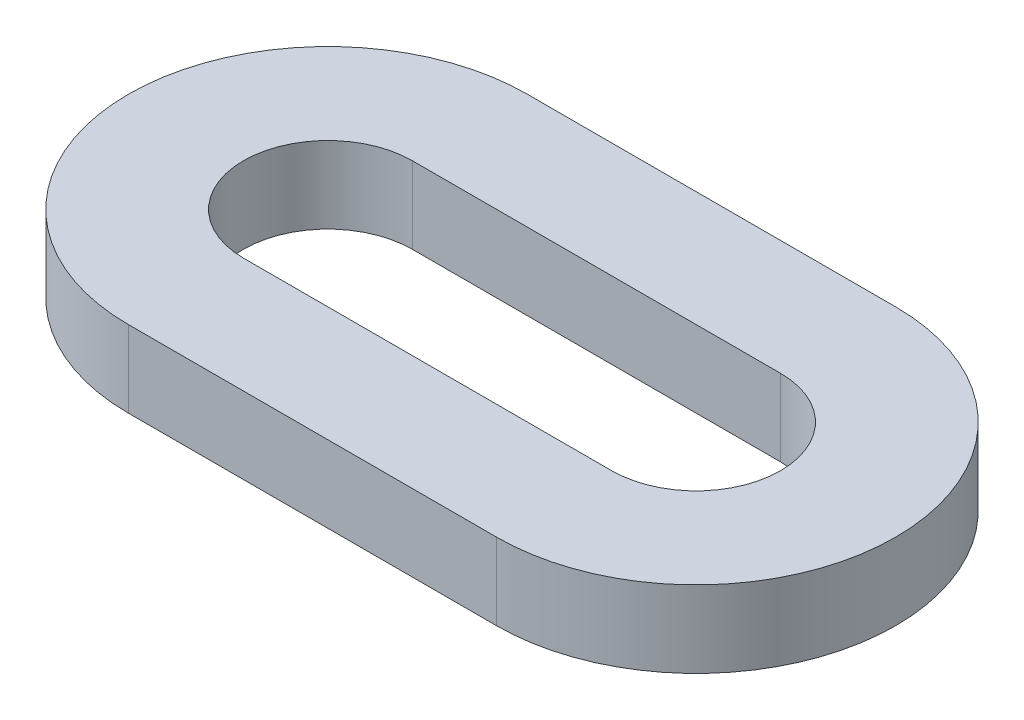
SolidWorks part; units mm, degrees
ref_plane "前视基准面" through (0, 0, 0) normal (0, 0, 1) x (1, 0, 0)
ref_plane "上视基准面" through (0, 0, 0) normal (0, 1, 0) x (1, 0, 0)
ref_plane "右视基准面" through (0, 0, 0) normal (1, 0, 0) x (0, 0, -1)
sketch "Sketch2" plane through (0, 0, 0) normal (0, 1, 0) x (1, 0, 0)
  line L0 (-40.5364, 0) -> (49.6296, 0) construction
  line L1 (-24, 26) -> (24, 26)
  line L2 (24, -26) -> (-24, -26)
  line L3 (0, 21.7114) -> (0, -32.6948) construction
  line L4 (24, -11) -> (-24, -11)
  line L5 (-24, 11) -> (24, 11)
  arc A0 (24, 26) -> (24, -26) centre (24, 0) cw
  arc A1 (-24, -26) -> (-24, 26) centre (-24, 0) cw
  arc A2 (-24, -11) -> (-24, 11) centre (-24, 0) cw
  arc A3 (24, 11) -> (24, -11) centre (24, 0) cw
  dimension "D2" = 26
  dimension "D1" = 48
  dimension "D3" = 15
extrude "拉伸1" add sketch "Sketch2" along normal blind 10
